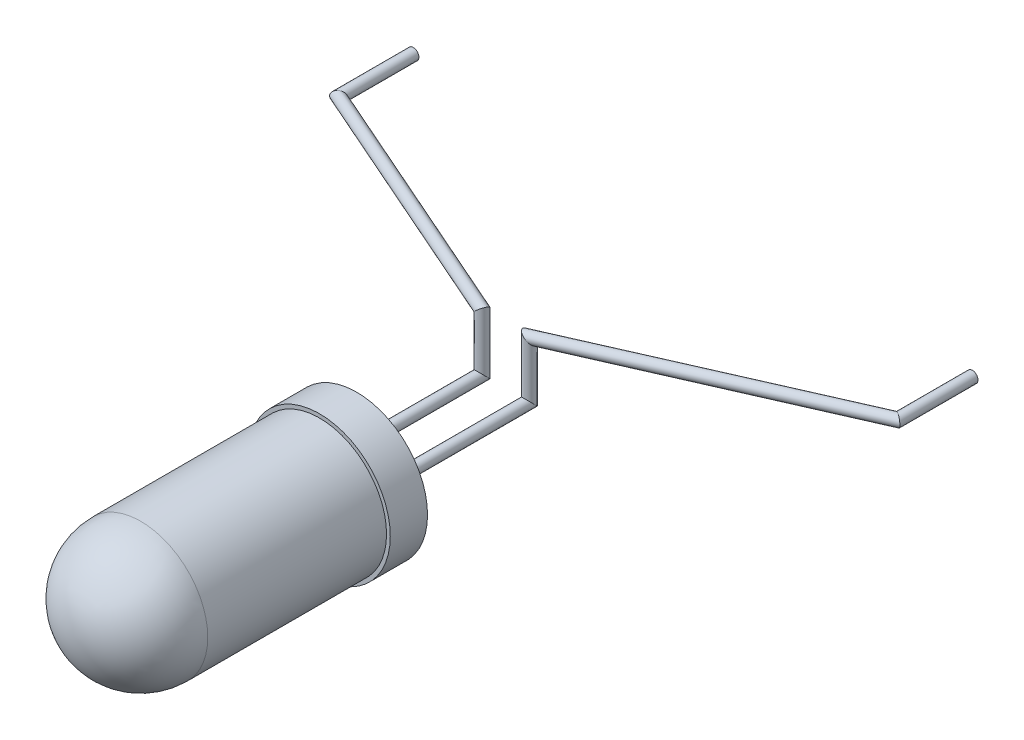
SolidWorks part; units mm, degrees
ref_plane "xy" through (0, 0, 0) normal (0, 0, 1) x (1, 0, 0)
ref_plane "xz" through (0, 0, 0) normal (0, 1, 0) x (1, 0, 0)
ref_plane "yz" through (0, 0, 0) normal (1, 0, 0) x (0, 0, -1)
sketch "Esquisse1" plane through (0, 0, 0) normal (0, 0, 1) x (1, 0, 0)
  circle A0 centre (0, 0) radius 1.9
  dimension "D1" = 3.8
extrude "Base-Extrusion" add sketch "Esquisse1" along normal blind 1
sketch "Esquisse2" plane through (0, 0, 1) normal (0, 0, 1) x (1, 0, 0)
  circle A2 centre (0, 0) radius 1.8
  circle A3 centre (0, 0) radius 1.8
  dimension "D1" = 0.1
extrude "Boss.-Extru.1" add sketch "Esquisse2" along normal blind 4.8
dome "Dôme1" faces to dome 1 distance 1.8 parameters "D1"=1.8
sketch "Esquisse4" plane through (0, 0, 0) normal (0, 0, -1) x (-1, 0, 0)
  line L0 (0, 0.5969) -> (0, -0.7217) construction
  circle A0 centre (-0.635, 0) radius 0.15
  dimension "D1" = 0.3
  dimension "D2" = 0.635
sketch3d "Esquisse3D3"
  line L0 (0.635, 0, 0) -> (0.635, 0, -4)
  line L1 (0.635, 0, -4) -> (0.635, 1.5, -4)
  line L2 (0.635, 1.5, -4) -> (7.505, 1.5, -7.0232)
  line L3 (7.505, 1.5, -7.0232) -> (7.505, 1.5, -9.0232)
  line L4 (6.25, 0.65, -7.55) -> (8.75, 0.65, -7.55) construction
  dimension "D1" = 1
  dimension "D2" = 2
  dimension "D3" = 4
  dimension "D4" = 1.5
sweep "FIL" add profiles "Esquisse4" path "Esquisse3D3"
mirror "Symétrie1" about plane through (0, 0, 0) normal (1, 0, 0)
